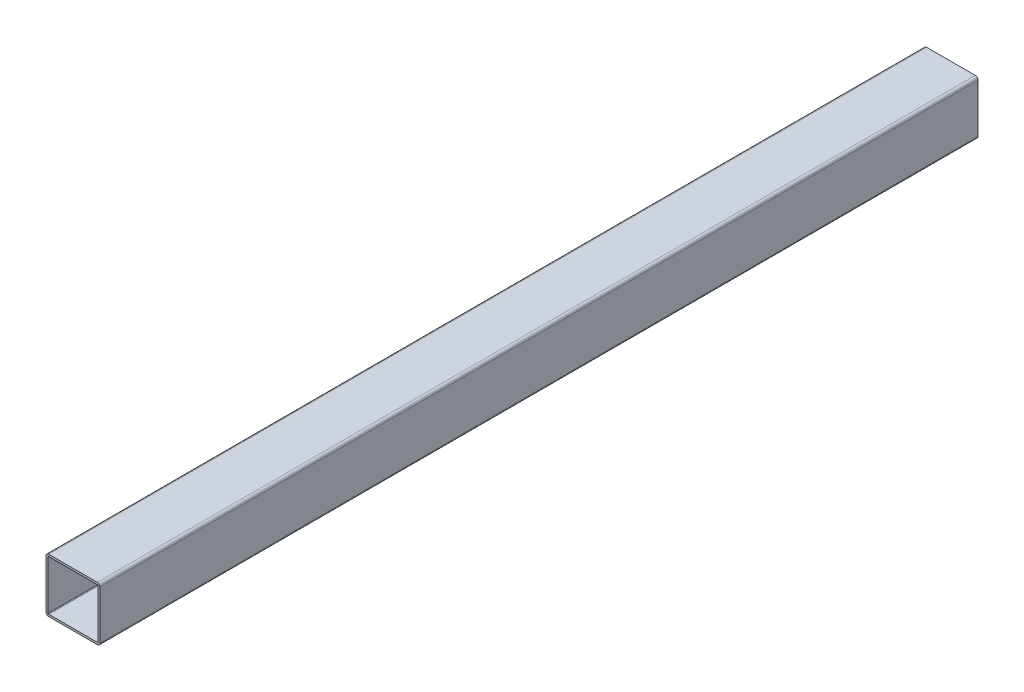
SolidWorks part; units mm, degrees
ref_plane "Face" through (0, 0, 0) normal (0, 0, 1) x (1, 0, 0)
ref_plane "Dessus" through (0, 0, 0) normal (0, 1, 0) x (1, 0, 0)
ref_plane "Droite" through (0, 0, 0) normal (1, 0, 0) x (0, 0, -1)
sketch "Esquisse1" plane through (0, 0, 0) normal (0, 0, 1) x (1, 0, 0)
  line L0 (4, -3) -> (76, -3)
  line L1 (4, 0) -> (76, 0)
  line L2 (0, -4) -> (0, -76)
  line L3 (4, -80) -> (76, -80)
  line L4 (80, -4) -> (80, -76)
  line L5 (77, -4) -> (77, -76)
  line L6 (4, -77) -> (76, -77)
  line L7 (3, -4) -> (3, -76)
  arc A0 (76, -80) -> (80, -76) centre (76, -76) ccw
  arc A1 (0, -76) -> (4, -80) centre (4, -76) ccw
  arc A2 (4, 0) -> (0, -4) centre (4, -4) ccw
  arc A3 (80, -4) -> (76, 0) centre (76, -4) ccw
  arc A4 (77, -4) -> (76, -3) centre (76, -4) ccw
  arc A5 (76, -77) -> (77, -76) centre (76, -76) ccw
  arc A6 (3, -76) -> (4, -77) centre (4, -76) ccw
  arc A7 (4, -3) -> (3, -4) centre (4, -4) ccw
  point P9 (0, -80)
  point P12 (0, 0)
  point P15 (80, 0)
  dimension "D3" = 4
  dimension "D1" = 80
  dimension "D2" = 80
  dimension "D4" = 3
extrude "Base-Extrusion" add sketch "Esquisse1" along normal blind 1300
